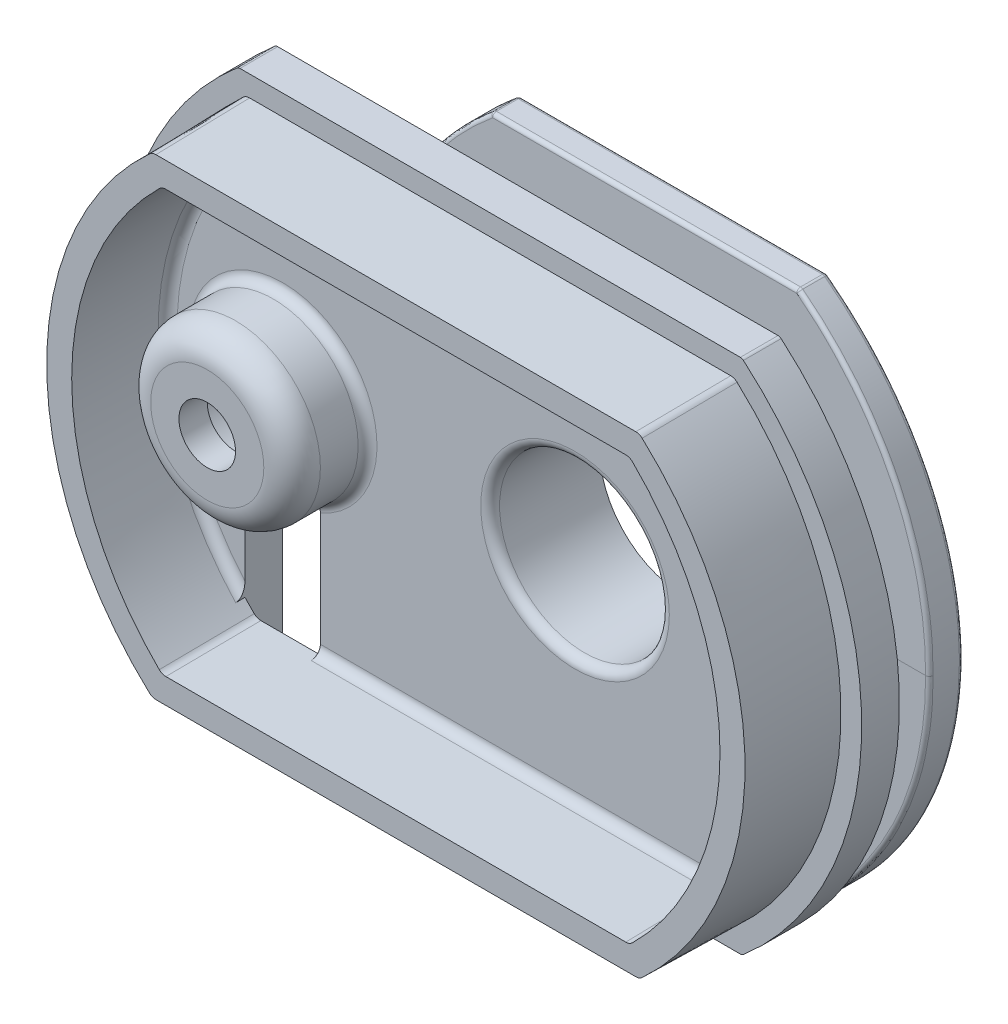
SolidWorks part; units mm, degrees
ref_plane "Płaszczyzna przednia" through (0, 0, 0) normal (0, 0, 1) x (1, 0, 0)
ref_plane "Płaszczyzna górna" through (0, 0, 0) normal (0, 1, 0) x (1, 0, 0)
ref_plane "Płaszczyzna prawa" through (0, 0, 0) normal (1, 0, 0) x (0, 0, -1)
sketch "Model" plane through (0, 0, 0) normal (0, 0, 1) x (1, 0, 0)
  line L6 (-1.0158, -12.5507) -> (0.9842, -12.5507)
  line L8 (-8.5601, 14.2073) -> (7.7031, 14.2073)
  line L9 (-15.3021, -0.0018) -> (14.7844, -0.0018) construction
  line L10 (-8.5601, -14.2109) -> (-1.0158, -14.2109)
  line L11 (-1.0158, -14.2109) -> (-1.0158, -12.5507)
  line L13 (0.9842, -12.5507) -> (0.9842, -14.2109)
  line L14 (0.9842, -14.2109) -> (7.7031, -14.2109)
  circle A7 centre (0, 0) radius 4.5
  arc A8 (7.7031, 14.2073) -> (7.7031, -14.2109) centre (-3.0109, -0.0018) cw
  arc A11 (-8.5601, 14.2073) -> (-8.5601, -14.2109) centre (3.0421, -0.0018) ccw
extrude "Dodanie-wyciągnięcie1" add sketch "Model" along normal blind 1.8
sketch "Szkic2" plane through (0, 0, 1.8) normal (0, 0, 1) x (1, 0, 0)
  circle A0 centre (0, 0) radius 4.5
  circle A1 centre (0, 0) radius 6.25
  dimension "D1" = 12.5
extrude "Dodanie-wyciągnięcie2" add sketch "Szkic2" along normal blind 2
sketch "Szkic3" plane through (0, 0, 3.8) normal (0, 0, 1) x (1, 0, 0)
  line L0 (-17.8938, -14.1) -> (8.8938, -14.1) construction
  line L1 (8.8938, 14.1) -> (-17.8938, 14.1) construction
  line L2 (-17.7649, -13.7) -> (8.7649, -13.7)
  line L3 (8.7649, 13.7) -> (-17.7649, 13.7)
  line L4 (-17.8571, -13.7) -> (8.8571, -13.7) construction
  line L5 (8.8571, 13.7) -> (-17.8571, 13.7) construction
  circle A0 centre (-15.5, 0) radius 1.5
  circle A1 centre (0, 0) radius 4.5
  arc A2 (-17.8938, 14.1) -> (-18.0873, 14.0292) centre (-17.8938, 13.8002) ccw construction
  arc A3 (-18.0873, 14.0292) -> (-18.0873, -14.0292) centre (-6.2333, 0) ccw construction
  arc A4 (-18.0873, -14.0292) -> (-17.8938, -14.1) centre (-17.8938, -13.8002) ccw construction
  arc A5 (8.8938, -14.1) -> (9.0873, -14.0292) centre (8.8938, -13.8002) ccw construction
  arc A6 (9.0873, -14.0292) -> (9.0873, 14.0292) centre (-2.7667, 0) ccw construction
  arc A7 (9.0873, 14.0292) -> (8.8938, 14.1) centre (8.8938, 13.8002) ccw construction
  circle A8 centre (0, 0) radius 4.5 construction
  circle A9 centre (-15.5, 0) radius 3.5 construction
  arc A10 (-17.9277, 13.6398) -> (-17.9277, -13.6398) centre (-6.2333, 0) ccw
  arc A13 (8.9277, -13.6398) -> (8.9277, 13.6398) centre (-2.7667, 0) ccw
  arc A16 (-17.8571, 13.7) -> (-17.8571, -13.7) centre (-6.2333, 0) ccw construction
  arc A17 (-17.9277, -13.6398) -> (-17.7649, -13.7) centre (-17.7649, -13.45) ccw
  arc A18 (-17.8571, -13.7) -> (-17.8571, -13.7) centre (-17.8571, -13.7) ccw construction
  arc A19 (8.8571, -13.7) -> (8.8571, 13.7) centre (-2.7667, 0) ccw construction
  arc A20 (8.9277, -13.6398) -> (8.7649, -13.7) centre (8.7649, -13.45) cw
  arc A21 (8.8571, -13.7) -> (8.8571, -13.7) centre (8.8571, -13.7) ccw construction
  arc A22 (8.9277, 13.6398) -> (8.7649, 13.7) centre (8.7649, 13.45) ccw
  arc A23 (8.8571, 13.7) -> (8.8571, 13.7) centre (8.8571, 13.7) ccw construction
  arc A24 (-17.7649, 13.7) -> (-17.9277, 13.6398) centre (-17.7649, 13.45) ccw
  arc A25 (-17.8571, 13.7) -> (-17.8571, 13.7) centre (-17.8571, 13.7) ccw construction
  dimension "D3" = 7
  dimension "D5" = 0.25
  dimension "D6" = 3
  dimension "D1" = 15.5
  dimension "D2" = 28.2
  dimension "D4" = 0.4
extrude "Dodanie-wyciągnięcie3" add sketch "Szkic3" along normal blind 2
sketch "Szkic5" plane through (0, 0, 5.8) normal (0, 0, 1) x (1, 0, 0)
  circle A0 centre (-15.5, 0) radius 4.5
  dimension "D1" = 9
extrude "Dodanie-wyciągnięcie4" add sketch "Szkic5" along normal blind 4
sketch "Szkic6" plane through (0, 0, 5.8) normal (0, 0, -1) x (-1, 0, 0)
  circle A0 centre (15.5, 0) radius 1.5
  dimension "D2" = 3
extrude "Wytnij-wyciągnięcie1" cut sketch "Szkic6" against normal blind 23
sketch "Szkic7" plane through (0, 0, 3.8) normal (0, 0, -1) x (-1, 0, 0)
  circle A0 centre (15.5, 0) radius 3
  dimension "D1" = 6
extrude "Wytnij-wyciągnięcie2" cut sketch "Szkic7" against normal blind 2
sketch "Szkic8" plane through (0, 0, 3.8) normal (0, 0, -1) x (-1, 0, 0)
  line L15 (24.2, 0) -> (8.0519, 0) construction
  line L16 (17.5, 0.2599) -> (17.5, -15.5218)
  line L17 (13.5, -15.5218) -> (13.5, 0.2599)
  line L18 (17.5, -15.5218) -> (13.5, -15.5218)
  line L19 (13.5, 0.2599) -> (17.5, 0.2599)
  arc A0 (17.9277, -13.6398) -> (17.9277, 13.6398) centre (6.2333, 0) ccw construction
extrude "Wytnij-wyciągnięcie4" cut sketch "Szkic8" against normal blind 2
fillet "Zaokrąglenie2" radius 1.5 1 edges at (-11, 0, 9.8)
sketch "Szkic12" plane through (0, 0, 5.8) normal (0, 0, -1) x (-1, 0, 0)
  circle A0 centre (15.5, 0) radius 3
extrude "Wytnij-wyciągnięcie5" cut sketch "Szkic12" against normal blind 2.5
sketch "Szkic14" plane through (0, 0, 5.8) normal (0, 0, 1) x (1, 0, 0)
  line L2 (8.446, 12.6) -> (-17.446, 12.6)
  line L3 (-17.446, -12.6) -> (8.446, -12.6)
  line L6 (-16.8599, -11.1) -> (7.8599, -11.1)
  line L7 (7.8599, 11.1) -> (-16.8599, 11.1)
  arc A3 (-17.446, 12.6) -> (-17.446, -12.6) centre (-6.2333, 0) ccw
  arc A4 (8.446, -12.6) -> (8.446, 12.6) centre (-2.7667, 0) ccw
  arc A6 (-16.8599, 11.1) -> (-16.8599, -11.1) centre (-6.2333, 0) ccw
  arc A7 (7.8599, -11.1) -> (7.8599, 11.1) centre (-2.7667, 0) ccw
  dimension "D1" = 1.5
extrude "Dodanie-wyciągnięcie6" add sketch "Szkic14" along normal blind 5 draft 1
fillet "Zaokrąglenie3" radius 0.5 1 edges at (4.5, 0, 5.8)
fillet "Zaokrąglenie4" radius 0.5
sketch "Szkic18" plane through (0, 0, 0) normal (0, 0, -1) x (-1, 0, 0)
  circle A0 centre (15.5, 0) radius 4
extrude "Wytnij-wyciągnięcie8" cut sketch "Szkic18" against normal blind 2
fillet "Zaokrąglenie5" radius 0.5 9 edges at (-4.5, 11.1, 5.8) (12.6, 0, 5.8) (-2.82, -11.1, 5.8) (-21.5932, 0.4562, 5.8) (-15.5, 4.5, 5.8)
fillet "Zaokrąglenie6" radius 0.5 4 edges
sketch "Szkic21" plane through (0, 0, 0) normal (0, 0, -1) x (-1, 0, 0)
  circle A0 centre (0, 0) radius 15
sketch "Szkic22" plane through (0, 0, 0) normal (1, 0, 0) x (0, 0, -1)
  line L0 (-1.8, 0) -> (-1.676, 14.2073)
  line L1 (-1.8, 6.25) -> (-1.8, -6.25) construction
  line L2 (-1.8, 0) -> (-1.676, 14.2073)
  line L3 (-1.8, 14.2073) -> (0, 14.2073) construction
  line L4 (-1.676, 14.2073) -> (-1.676, 15.0083)
  line L5 (-1.676, 15.0083) -> (-2.5889, 15.0083)
  line L6 (-2.5889, 15.0083) -> (-2.5889, -15.0083)
  line L8 (-1.8, 14.2073) -> (-1.8, -12.5507) construction
  line L9 (-0.9, 14.2073) -> (-0.9, 12.0586) construction
  line L11 (0.7889, 15.0083) -> (0.7889, -15.0083)
  line L12 (-0.124, 15.0083) -> (0.7889, 15.0083)
  line L13 (-0.124, 14.2073) -> (-0.124, 15.0083)
  line L14 (0, 0) -> (-0.124, 14.2073)
  line L15 (-1.676, 14.2073) -> (-1.676, 15.0083)
  line L16 (-1.676, 15.0083) -> (-2.5889, 15.0083)
  line L17 (-2.5889, 15.0083) -> (-2.5889, -15.0083)
  line L20 (0.7889, 15.0083) -> (0.7889, -15.0083)
  line L21 (-0.124, 15.0083) -> (0.7889, 15.0083)
  line L22 (-0.124, 14.2073) -> (-0.124, 15.0083)
  line L23 (0, 0) -> (-0.124, 14.2073)
  line L24 (-1.8, 0) -> (-1.676, 14.2073)
  line L25 (-1.676, 14.2073) -> (-1.676, 15.0083)
  line L26 (-1.676, 15.0083) -> (-2.5889, 15.0083)
  line L27 (-2.5889, 15.0083) -> (-2.5889, -15.0083)
  line L30 (0.7889, 15.0083) -> (0.7889, -15.0083)
  line L31 (-0.124, 15.0083) -> (0.7889, 15.0083)
  line L32 (-0.124, 14.2073) -> (-0.124, 15.0083)
  line L33 (-1.8, 0) -> (-1.676, 14.2073)
  line L34 (-1.676, 14.2073) -> (-1.676, 15.0083)
  line L35 (-1.676, 15.0083) -> (-2.5889, 15.0083)
  line L36 (-2.5889, 15.0083) -> (-2.5889, -15.0083)
  line L39 (0.7889, 15.0083) -> (0.7889, -15.0083)
  line L40 (-0.124, 15.0083) -> (0.7889, 15.0083)
  line L41 (-0.124, 14.2073) -> (-0.124, 15.0083)
  line L42 (0, 0) -> (-0.124, 14.2073)
  line L43 (0, 0) -> (-0.124, 14.2073)
  line L44 (-0.9, -14.2073) -> (-0.9, -12.0586) construction
  line L45 (0, 0) -> (-0.124, -14.2073)
  line L46 (0, 0) -> (-0.124, -14.2073)
  line L47 (-0.124, -14.2073) -> (-0.124, -15.0083)
  line L48 (-0.124, -15.0083) -> (0.7889, -15.0083)
  line L49 (-1.676, -15.0083) -> (-2.5889, -15.0083)
  line L50 (-1.676, -14.2073) -> (-1.676, -15.0083)
  line L51 (-1.8, 0) -> (-1.676, -14.2073)
  line L52 (-0.124, -14.2073) -> (-0.124, -15.0083)
  line L53 (-0.124, -15.0083) -> (0.7889, -15.0083)
  line L54 (-1.676, -15.0083) -> (-2.5889, -15.0083)
  line L55 (-1.676, -14.2073) -> (-1.676, -15.0083)
  line L56 (-1.8, 0) -> (-1.676, -14.2073)
  line L57 (0, 0) -> (-0.124, -14.2073)
  line L58 (-0.124, -14.2073) -> (-0.124, -15.0083)
  line L59 (-0.124, -15.0083) -> (0.7889, -15.0083)
  line L60 (-1.676, -15.0083) -> (-2.5889, -15.0083)
  line L61 (-1.676, -14.2073) -> (-1.676, -15.0083)
  line L62 (0, 0) -> (-0.124, -14.2073)
  line L63 (-0.124, -14.2073) -> (-0.124, -15.0083)
  line L64 (-0.124, -15.0083) -> (0.7889, -15.0083)
  line L65 (-1.676, -15.0083) -> (-2.5889, -15.0083)
  line L66 (-1.676, -14.2073) -> (-1.676, -15.0083)
  line L67 (-1.8, 0) -> (-1.676, -14.2073)
  line L68 (-1.8, 0) -> (-1.676, -14.2073)
  dimension "D1" = 0.5
extrude "Wytnij-wyciągnięcie9" cut sketch "Szkic22" against normal through all both and the other way through all contours L47 L48 L11 L12 L13 L14 L45 | L51 L0 L4 L5 L6 L49 L50
sketch "Szkic24" plane through (0, 0, 3.8) normal (0, 0, -1) x (-1, 0, 0)
  line L1 (19, 15.474) -> (13, 15.474)
  line L2 (19, 15.474) -> (19, -16.8165)
  line L3 (19, -16.8165) -> (13, -16.8165)
  line L4 (13, 15.474) -> (13, -16.8165)
  dimension "D1" = 0.5
extrude "Wytnij-wyciągnięcie10" cut sketch "Szkic24" along normal blind 8
sketch "Szkic23" plane through (0, 0, 2.5889) normal (0, 0, -1) x (-1, 0, 0)
  circle A0 centre (0, 0) radius 6.25
  circle A1 centre (0, 0) radius 4.5
extrude "Dodanie-wyciągnięcie8" add sketch "Szkic23" along normal blind 2
fillet "Zaokrąglenie8" radius 0.2 12 edges at (-1.0158, -14.2091, 0.124) (0.9842, -14.2091, 0.124) (0.9842, -14.2091, 1.676) (-1.0158, -14.2091, 1.676) (-1.0158, -13.379, 1.6832) (0.9842, -13.379, 1.6832) (0.9842, -13.379, 0.1168) (-1.0158, -13.379, 0.1168) (-0.0158, -12.5507, 1.6905) (0.9842, -12.5507, 0.9) (-0.0158, -12.5507, 0.1095) (-1.0158, -12.5507, 0.9)
fillet "Zaokrąglenie9" radius 0.2 24 edges at (-13, 6.009, 0.0524) (-13, 8.8954, 0.9) (-13, 6.009, 1.7476) (-13, -6.0108, 1.7475) (-13, -8.899, 0.9) (-13, -6.0108, 0.0525) (-11.8944, 1.7321, 1.7849) (-11.8944, -1.7321, 1.7849) (-13, -3.1225, 0.9) (-11.8944, -1.7321, 0.0151) (-11.8944, 1.7321, 0.0151) (-13, 3.1225, 0.9) (1.0427, -14.2109, 1.6174) (4.4436, -14.2109, 1.676) (7.7031, -14.2109, 0.9) (4.4436, -14.2109, 0.124) (1.0427, -14.2109, 0.1826) (0.9842, -14.2109, 0.9) (-8.5601, -14.2109, 0.9) (-4.888, -14.2109, 1.676) (-1.0744, -14.2109, 1.6174) (-1.0158, -14.2109, 0.9) (-1.0744, -14.2109, 0.1826) (-4.888, -14.2109, 0.124)
fillet "Zaokrąglenie10" radius 0.2 20 edges at (7.6998, -14.2004, 0.2584) (7.6998, -14.2004, 1.5416) (-12.9936, 8.8939, 1.5728) (-12.9936, 8.8939, 0.2272) (-12.9936, -8.8975, 0.2273) (-8.5561, -14.1992, 0.2548) (-12.9936, -8.8975, 1.5727) (-8.5561, -14.1992, 1.5452) (12.9159, 7.937, 1.7307) (12.9159, 7.937, 0.0693) (12.9886, -7.7931, 0.068) (12.9886, -7.7931, 1.732) (7.7031, 14.2073, 0.9) (-0.4285, 14.2073, 1.676) (-0.4285, 14.2073, 0.124) (-8.5601, 14.2073, 0.9) (-10.9024, 11.9171, 1.696) (-10.9024, 11.9171, 0.104) (-11.0027, -11.8024, 0.103) (-11.0027, -11.8024, 1.697)
